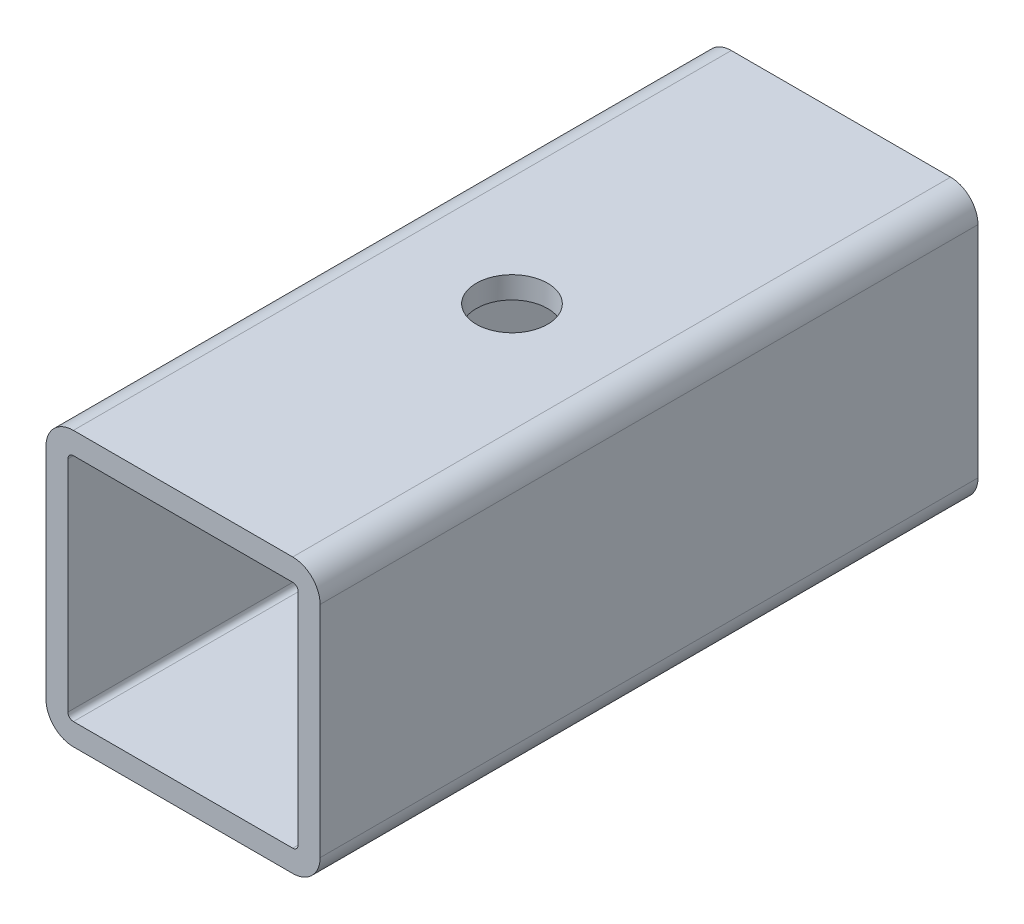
SolidWorks part; units mm, degrees
ref_plane "Face" through (0, 0, 0) normal (0, 0, 1) x (1, 0, 0)
ref_plane "Dessus" through (0, 0, 0) normal (0, 1, 0) x (1, 0, 0)
ref_plane "Droite" through (0, 0, 0) normal (1, 0, 0) x (0, 0, -1)
sketch "Esquisse1" plane through (0, 0, 0) normal (0, 0, 1) x (1, 0, 0)
  line L0 (5, -4) -> (45, -4)
  line L1 (5, 0) -> (45, 0)
  line L2 (0, -5) -> (0, -45)
  line L3 (5, -50) -> (45, -50)
  line L4 (50, -5) -> (50, -45)
  line L5 (46, -5) -> (46, -45)
  line L6 (5, -46) -> (45, -46)
  line L7 (4, -5) -> (4, -45)
  arc A0 (50, -5) -> (45, 0) centre (45, -5) ccw
  arc A1 (45, -50) -> (50, -45) centre (45, -45) ccw
  arc A2 (5, 0) -> (0, -5) centre (5, -5) ccw
  arc A3 (5, -50) -> (0, -45) centre (5, -45) cw
  arc A4 (46, -5) -> (45, -4) centre (45, -5) ccw
  arc A5 (45, -46) -> (46, -45) centre (45, -45) ccw
  arc A6 (5, -46) -> (4, -45) centre (5, -45) cw
  arc A7 (5, -4) -> (4, -5) centre (5, -5) ccw
  point P7 (50, 0)
  point P12 (0, 0)
  point P15 (0, -50)
  dimension "D3" = 5
  dimension "D1" = 50
  dimension "D2" = 50
  dimension "D4" = 4
extrude "Base-Extrusion" add sketch "Esquisse1" along normal blind 120
sketch "Esquisse2" plane through (0, 0, 0) normal (0, 1, 0) x (-1, 0, 0)
  line L0 (-45, 0) -> (-5, 0) construction
  line L1 (0, 120) -> (0, 0) construction
  circle A0 centre (-25, 60) radius 6.5
  dimension "D1" = 13
  dimension "D2" = 60
  dimension "D3" = 25
extrude "Enlèv. mat.-Extru.1" cut sketch "Esquisse2" against normal through all
